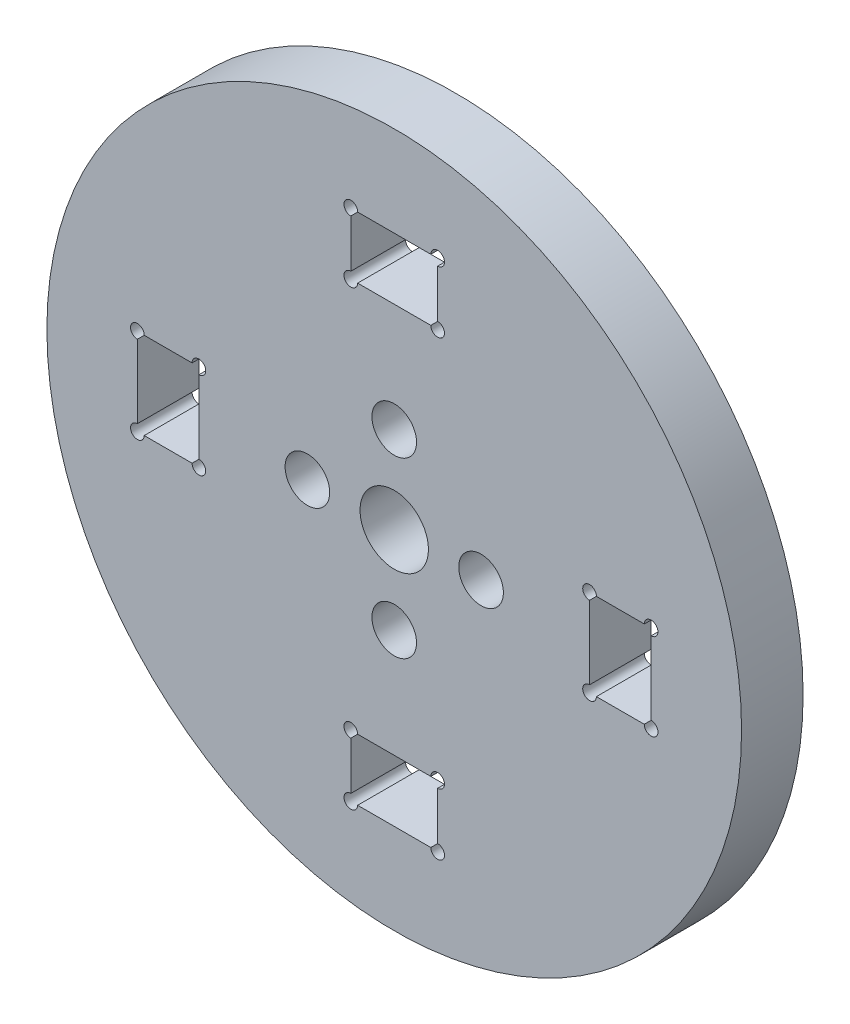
SolidWorks part; units mm, degrees
ref_plane "Front Plane" through (0, 0, 0) normal (0, 0, 1) x (1, 0, 0)
ref_plane "Top Plane" through (0, 0, 0) normal (0, 1, 0) x (1, 0, 0)
ref_plane "Right Plane" through (0, 0, 0) normal (1, 0, 0) x (0, 0, -1)
sketch "Sketch1" plane through (0, 0, 0) normal (0, 0, 1) x (1, 0, 0)
  circle A0 centre (0, 0) radius 2.5
  circle A1 centre (0, 0) radius 25.4
  dimension "D1" = 5
  dimension "D2" = 50.8
extrude "Boss-Extrude1" add sketch "Sketch1" along normal blind 4.5
sketch "Sketch2" plane through (0, 0, 4.5) normal (0, 0, 1) x (1, 0, 0)
  line L0 (0, 18.7836) -> (0, 14.2836) construction
  line L1 (-3.175, 18.7836) -> (3.175, 18.7836)
  line L2 (-3.175, 18.7836) -> (-3.175, 14.2836)
  line L3 (-3.175, 14.2836) -> (3.175, 14.2836)
  line L4 (3.175, 18.7836) -> (3.175, 14.2836)
  line L5 (14.2836, 3.175) -> (14.2836, -3.175)
  line L6 (18.7836, 3.175) -> (14.2836, 3.175)
  line L7 (18.7836, 3.175) -> (18.7836, -3.175)
  line L8 (18.7836, -3.175) -> (14.2836, -3.175)
  line L9 (3.175, -14.2836) -> (-3.175, -14.2836)
  line L10 (3.175, -18.7836) -> (3.175, -14.2836)
  line L11 (3.175, -18.7836) -> (-3.175, -18.7836)
  line L12 (-3.175, -18.7836) -> (-3.175, -14.2836)
  line L13 (-14.2836, -3.175) -> (-14.2836, 3.175)
  line L14 (-18.7836, -3.175) -> (-14.2836, -3.175)
  line L15 (-18.7836, -3.175) -> (-18.7836, 3.175)
  line L16 (-18.7836, 3.175) -> (-14.2836, 3.175)
  circle A0 centre (0, 0) radius 19.05
  circle A1 centre (0, 0) radius 17.4625
  arc A2 (-2.675, 18.7836) -> (-3.175, 18.2836) centre (-3.175, 18.7836) ccw
  arc A3 (-3.175, 14.7836) -> (-2.675, 14.2836) centre (-3.175, 14.2836) ccw
  arc A4 (3.175, 14.7836) -> (2.675, 14.2836) centre (3.175, 14.2836) cw
  arc A5 (2.675, 18.7836) -> (3.175, 18.2836) centre (3.175, 18.7836) cw
  arc A6 (18.7836, 2.675) -> (18.2836, 3.175) centre (18.7836, 3.175) ccw
  arc A7 (18.7836, -2.675) -> (18.2836, -3.175) centre (18.7836, -3.175) cw
  arc A8 (14.7836, -3.175) -> (14.2836, -2.675) centre (14.2836, -3.175) cw
  arc A9 (14.7836, 3.175) -> (14.2836, 2.675) centre (14.2836, 3.175) ccw
  arc A10 (2.675, -18.7836) -> (3.175, -18.2836) centre (3.175, -18.7836) ccw
  arc A11 (-2.675, -18.7836) -> (-3.175, -18.2836) centre (-3.175, -18.7836) cw
  arc A12 (-3.175, -14.7836) -> (-2.675, -14.2836) centre (-3.175, -14.2836) cw
  arc A13 (3.175, -14.7836) -> (2.675, -14.2836) centre (3.175, -14.2836) ccw
  arc A14 (-18.7836, -2.675) -> (-18.2836, -3.175) centre (-18.7836, -3.175) ccw
  arc A15 (-18.7836, 2.675) -> (-18.2836, 3.175) centre (-18.7836, 3.175) cw
  arc A16 (-14.7836, 3.175) -> (-14.2836, 2.675) centre (-14.2836, 3.175) cw
  arc A17 (-14.7836, -3.175) -> (-14.2836, -2.675) centre (-14.2836, -3.175) ccw
  point P26 (0, 0)
  dimension "D1" = 38.1
  dimension "D7" = 0.5
  dimension "D8" = 0.5
  dimension "D9" = 0.5
  dimension "D10" = 0.5
  dimension "D3" = 4.5
  dimension "D4" = 6.35
  dimension "D5" = 0
  dimension "D2" = 1.5875
  dimension "D6" = 4
extrude "Cut-Extrude1" cut sketch "Sketch2" against normal through all contours L16 A1 L14 L13 | A1 L16 L15 L14 | L1 L0 A1 L4 | L0 L1 L2 A1 | L0 A1 L2 L3 | A1 L0 L3 L4 | L8 A1 L6 L5 | A1 L8 L7 L6 | L12 A1 L10 L9 | A1 L12 L11 L10 | A0 A2 L2 | L1 A2 A0 | A0 A2 | A5 L1 A0 | A5 A0 | A5 A0 L4 | A4 L4 L3 | L2 A3 L3 | A8 L8 L5 | L6 A9 L5 | A0 A6 L6 | A0 A6 | L7 A6 A0 | A7 A0 L8 | A7 A0 | A7 L7 A0 | A11 A0 | A12 L12 L9 | L10 A13 L9 | A0 A10 | A0 A10 L10 | L11 A10 A0 | A11 A0 L12 | A11 L11 A0 | A15 A0 | A15 A0 L16 | A15 L15 A0 | A16 L16 L13 | L14 A17 L13 | A0 A14 L14 | A0 A14 | L15 A14 A0
sketch "Sketch3" plane through (0, 0, 4.5) normal (0, 0, 1) x (1, 0, 0)
  point P0 (0, 6.35)
  point P5 (6.35, 0)
  point P6 (0, -6.35)
  point P7 (-6.35, 0)
  point P8 (0, 0)
  dimension "D1" = 6.35
  dimension "D2" = 4
hole_wizard "#4 Clearance Hole1" positions "Sketch5" profile "Sketch4" hole size "#4" standard "ANSI Inch"
sketch "Sketch5" plane through (0, 0, 4.5) normal (0, 0, 1) x (1, 0, 0)
  point P0 (0, 6.35)
  point P3 (6.35, 0)
  point P6 (0, -6.35)
  point P9 (-6.35, 0)
sketch "Sketch4" plane through (0, 6.35, 4.5) normal (1, 0, 0) x (0, -1, 0)
  line L0 (0, 0) -> (0, 26.3806)
  line L1 (0, 26.3806) -> (1.6319, 25.4)
  line L2 (1.6319, 25.4) -> (1.6319, 0)
  line L5 (1.6319, 0) -> (0, 0)
  line L10 (0, 26.3806) -> (-1.632, 25.4) construction
  line L11 (0, -6.35) -> (0, 107.95) construction
  dimension "Hole Dia." = 3.2639
  dimension "Hole Depth" = 25.4
  dimension "Drill Angle" = 118
